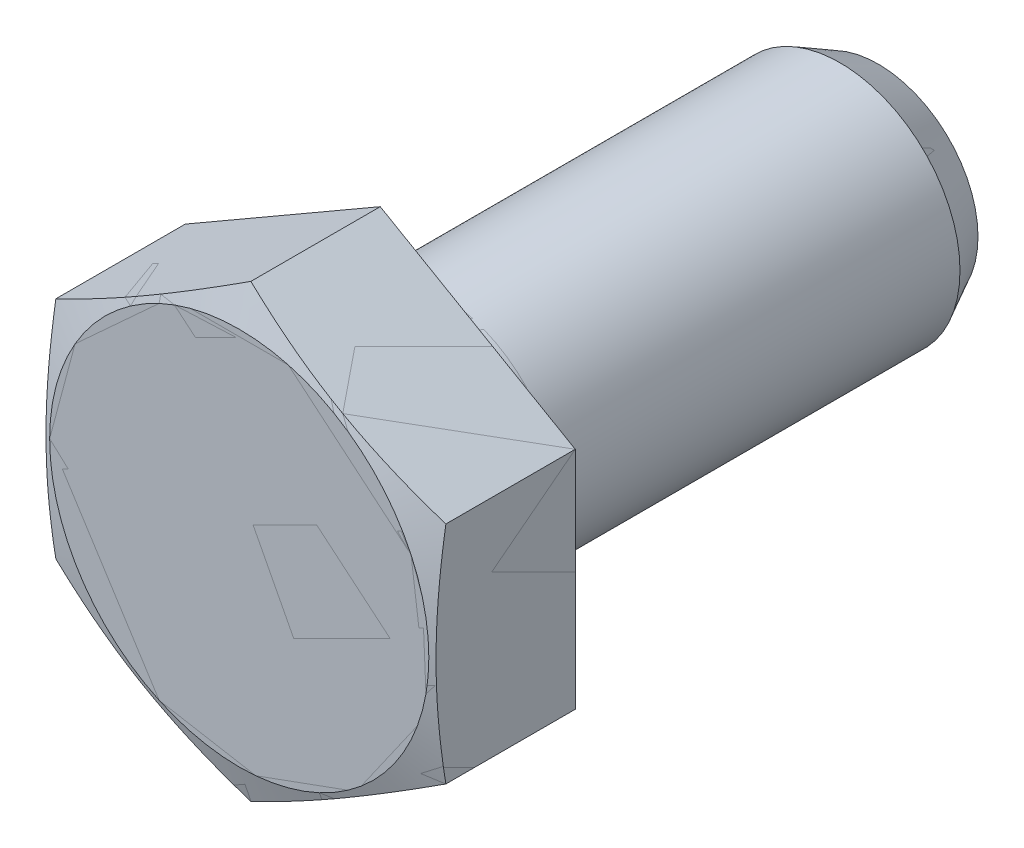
SolidWorks part; units mm, degrees
ref_plane "Face" through (0, 0, 0) normal (0, 0, 1) x (1, 0, 0)
ref_plane "Dessus" through (0, 0, 0) normal (0, 1, 0) x (1, 0, 0)
ref_plane "Droite" through (0, 0, 0) normal (1, 0, 0) x (0, 0, -1)
imported_body "Vis H M8-16 - 6,8, Grade A, type 2 - NF E 25-114"
sketch "Esquisse1" plane through (0, 0, -2.544) normal (0, 0, 1) x (1, 0, 0)
  circle A0 centre (0, 0) radius 4 construction
  circle A1 centre (0, 0) radius 4
extrude "Boss.-Extru.1" add sketch "Esquisse1" along normal up to next
